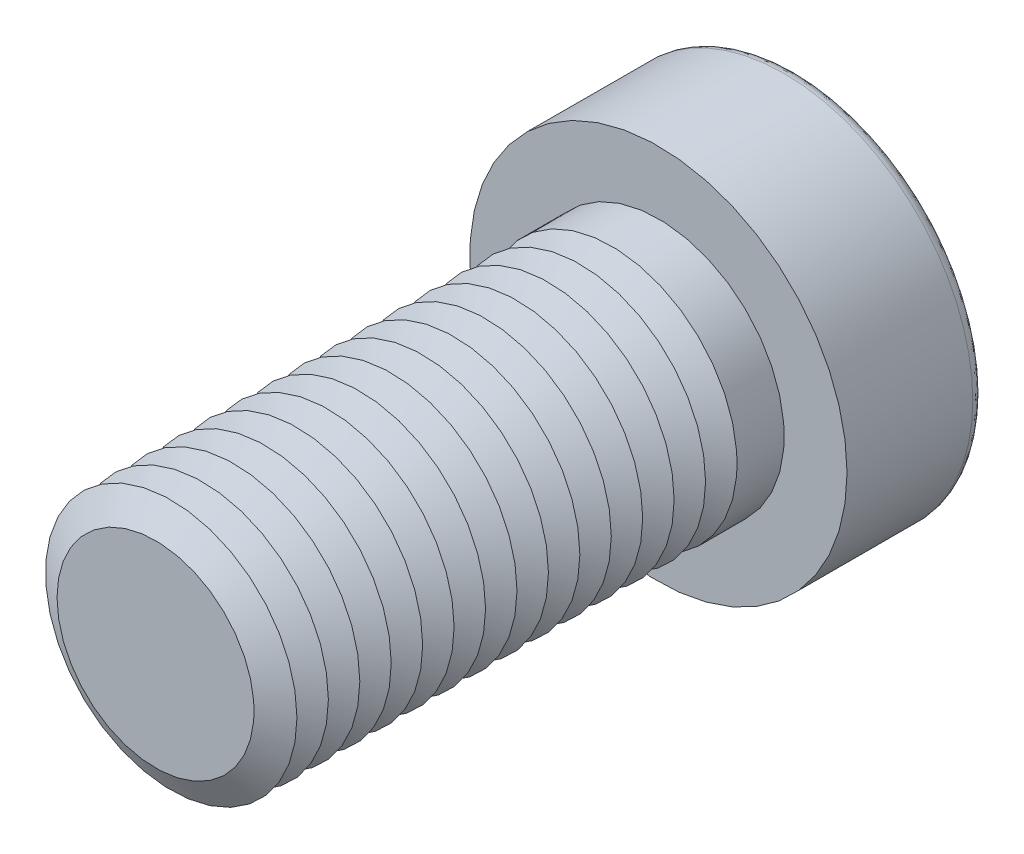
SolidWorks part; units mm, degrees
ref_plane "Front Plane" through (0, 0, 0) normal (0, 0, 1) x (1, 0, 0)
ref_plane "Top Plane" through (0, 0, 0) normal (0, 1, 0) x (1, 0, 0)
ref_plane "Right Plane" through (0, 0, 0) normal (1, 0, 0) x (0, 0, -1)
sketch "Sketch1" plane through (0, 0, 0) normal (0, 0, 1) x (1, 0, 0)
  circle A0 centre (0, 0) radius 10
  dimension "D1" = 20
extrude "Boss-Extrude1" add sketch "Sketch1" along normal blind 40
sketch "Sketch2" plane through (0, 0, 0) normal (0, 0, -1) x (-1, 0, 0)
  circle A0 centre (0, 0) radius 15
  dimension "D1" = 30
extrude "Boss-Extrude2" add sketch "Sketch2" along normal blind 11
sketch "Sketch3" plane through (0, 0, -11) normal (0, 0, -1) x (-1, 0, 0)
  line L1 (-4.0415, 7) -> (-8.0829, 0)
  line L2 (-8.0829, 0) -> (-4.0415, -7)
  line L3 (-4.0415, -7) -> (4.0415, -7)
  line L4 (4.0415, -7) -> (8.0829, 0)
  line L5 (8.0829, 0) -> (4.0415, 7)
  line L6 (4.0415, 7) -> (-4.0415, 7)
  circle A0 centre (0, 0) radius 7 construction
  dimension "D1" = 14
extrude "Cut-Extrude1" cut sketch "Sketch3" against normal blind 10.5
fillet "Fillet1" radius 1 1 edges at (-15, 0, -11)
sketch "Sketch4" plane through (0, 0, -0.5) normal (0, 0, -1) x (-1, 0, 0)
  line L0 (4.0415, -7) -> (8.0829, 0) construction
  circle A0 centre (0, 0) radius 7
extrude "Cut-Extrude2" cut sketch "Sketch4" against normal through all draft 60
sketch "Sketch5" plane through (0, 0, -11) normal (0, 0, -1) x (-1, 0, 0)
  circle A0 centre (0, 0) radius 8.0829
extrude "Cut-Extrude3" cut sketch "Sketch5" against normal through all draft 75
sketch "Sketch7" plane through (0, 0, 0) normal (1, 0, 0) x (0, 0, -1)
  line L25 (-40, 7.8349) -> (-38.75, 10)
  line L26 (-40, 10) -> (-40, -10) construction
  line L27 (-38.75, 10) -> (-41.25, 10)
  line L28 (-41.25, 10) -> (-40, 7.8349)
  line L29 (0, 10) -> (-40, 10) construction
  dimension "D1" = 2.5
revolve "Cut-Revolve1" cut sketch "Sketch7" angle 360 about axis through (0, 0, 40) along (0, 0, -1)
pattern_linear "LPattern1" count 15 spacing 2.5 along (0, 0, -1) of "Cut-Revolve1"
